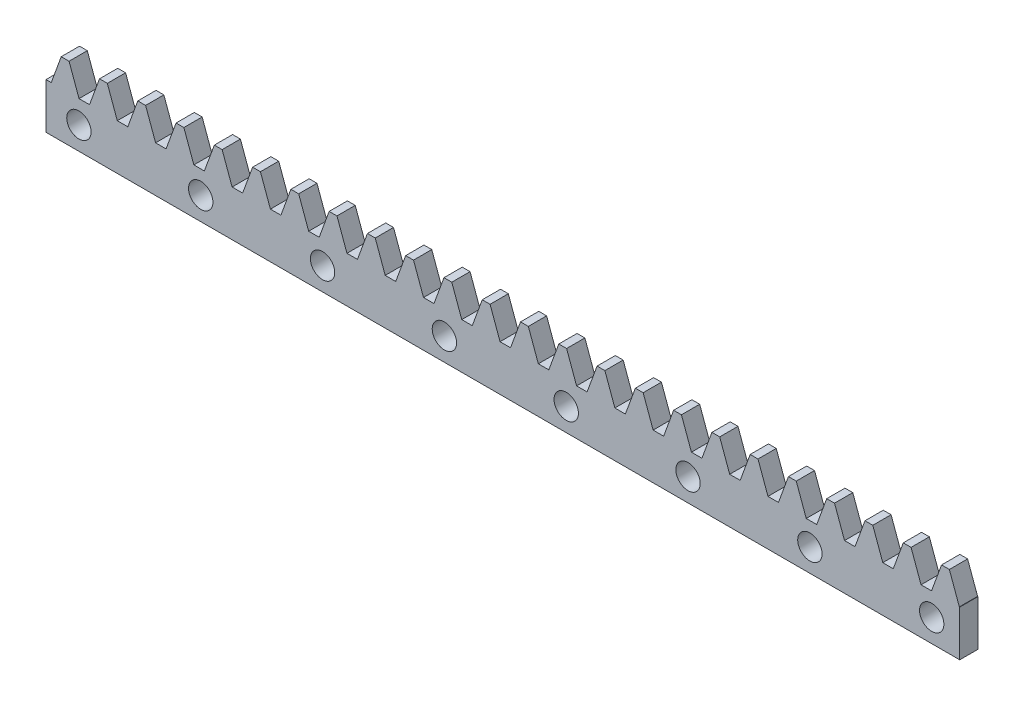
SolidWorks part; units mm, degrees
ref_plane "前视基准面" through (0, 0, 0) normal (0, 0, 1) x (1, 0, 0)
ref_plane "上视基准面" through (0, 0, 0) normal (0, 1, 0) x (1, 0, 0)
ref_plane "右视基准面" through (0, 0, 0) normal (1, 0, 0) x (0, 0, -1)
sketch "草图1" plane through (0, 0, 0) normal (0, 0, 1) x (1, 0, 0)
  line L200 (150, 7.5) -> (149.9346, 7.5)
  line L201 (149.9346, 7.5) -> (148.2967, 12)
  line L202 (148.2967, 12) -> (147.013, 12)
  line L203 (147.013, 12) -> (145.3751, 7.5)
  line L204 (145.3751, 7.5) -> (143.6514, 7.5)
  line L205 (143.6514, 7.5) -> (142.0135, 12)
  line L206 (142.0135, 12) -> (140.7298, 12)
  line L207 (140.7298, 12) -> (139.0919, 7.5)
  line L208 (139.0919, 7.5) -> (137.3682, 7.5)
  line L209 (137.3682, 7.5) -> (135.7303, 12)
  line L210 (135.7303, 12) -> (134.4466, 12)
  line L211 (134.4466, 12) -> (132.8088, 7.5)
  line L212 (132.8088, 7.5) -> (131.085, 7.5)
  line L213 (131.085, 7.5) -> (129.4472, 12)
  line L214 (129.4472, 12) -> (128.1634, 12)
  line L215 (128.1634, 12) -> (126.5256, 7.5)
  line L216 (126.5256, 7.5) -> (124.8018, 7.5)
  line L217 (124.8018, 7.5) -> (123.164, 12)
  line L218 (123.164, 12) -> (121.8803, 12)
  line L219 (121.8803, 12) -> (120.2424, 7.5)
  line L220 (120.2424, 7.5) -> (118.5186, 7.5)
  line L221 (118.5186, 7.5) -> (116.8808, 12)
  line L222 (116.8808, 12) -> (115.5971, 12)
  line L223 (115.5971, 12) -> (113.9592, 7.5)
  line L224 (113.9592, 7.5) -> (112.2355, 7.5)
  line L225 (112.2355, 7.5) -> (110.5976, 12)
  line L226 (110.5976, 12) -> (109.3139, 12)
  line L227 (109.3139, 12) -> (107.676, 7.5)
  line L228 (107.676, 7.5) -> (105.9523, 7.5)
  line L229 (105.9523, 7.5) -> (104.3144, 12)
  line L230 (104.3144, 12) -> (103.0307, 12)
  line L231 (103.0307, 12) -> (101.3928, 7.5)
  line L232 (101.3928, 7.5) -> (99.6691, 7.5)
  line L233 (99.6691, 7.5) -> (98.0312, 12)
  line L234 (98.0312, 12) -> (96.7475, 12)
  line L235 (96.7475, 12) -> (95.1097, 7.5)
  line L236 (95.1097, 7.5) -> (93.3859, 7.5)
  line L237 (93.3859, 7.5) -> (91.748, 12)
  line L238 (91.748, 12) -> (90.4643, 12)
  line L239 (90.4643, 12) -> (88.8265, 7.5)
  line L240 (88.8265, 7.5) -> (87.1027, 7.5)
  line L241 (87.1027, 7.5) -> (85.4649, 12)
  line L242 (85.4649, 12) -> (84.1811, 12)
  line L243 (84.1811, 12) -> (82.5433, 7.5)
  line L244 (82.5433, 7.5) -> (80.8195, 7.5)
  line L245 (80.8195, 7.5) -> (79.1817, 12)
  line L246 (79.1817, 12) -> (77.898, 12)
  line L247 (77.898, 12) -> (76.2601, 7.5)
  line L248 (76.2601, 7.5) -> (74.5364, 7.5)
  line L249 (74.5364, 7.5) -> (72.8985, 12)
  line L250 (72.8985, 12) -> (71.6148, 12)
  line L251 (71.6148, 12) -> (69.9769, 7.5)
  line L252 (69.9769, 7.5) -> (68.2532, 7.5)
  line L253 (68.2532, 7.5) -> (66.6153, 12)
  line L254 (66.6153, 12) -> (65.3316, 12)
  line L255 (65.3316, 12) -> (63.6937, 7.5)
  line L256 (63.6937, 7.5) -> (61.97, 7.5)
  line L257 (61.97, 7.5) -> (60.3321, 12)
  line L258 (60.3321, 12) -> (59.0484, 12)
  line L259 (59.0484, 12) -> (57.4105, 7.5)
  line L260 (57.4105, 7.5) -> (55.6868, 7.5)
  line L261 (55.6868, 7.5) -> (54.0489, 12)
  line L262 (54.0489, 12) -> (52.7652, 12)
  line L263 (52.7652, 12) -> (51.1274, 7.5)
  line L264 (51.1274, 7.5) -> (49.4036, 7.5)
  line L265 (49.4036, 7.5) -> (47.7657, 12)
  line L266 (47.7657, 12) -> (46.482, 12)
  line L267 (46.482, 12) -> (44.8442, 7.5)
  line L268 (44.8442, 7.5) -> (43.1204, 7.5)
  line L269 (43.1204, 7.5) -> (41.4826, 12)
  line L270 (41.4826, 12) -> (40.1988, 12)
  line L271 (40.1988, 12) -> (38.561, 7.5)
  line L272 (38.561, 7.5) -> (36.8372, 7.5)
  line L273 (36.8372, 7.5) -> (35.1994, 12)
  line L274 (35.1994, 12) -> (33.9157, 12)
  line L275 (33.9157, 12) -> (32.2778, 7.5)
  line L276 (32.2778, 7.5) -> (30.5541, 7.5)
  line L277 (30.5541, 7.5) -> (28.9162, 12)
  line L278 (28.9162, 12) -> (27.6325, 12)
  line L279 (27.6325, 12) -> (25.9946, 7.5)
  line L280 (25.9946, 7.5) -> (24.2709, 7.5)
  line L281 (24.2709, 7.5) -> (22.633, 12)
  line L282 (22.633, 12) -> (21.3493, 12)
  line L283 (21.3493, 12) -> (19.7114, 7.5)
  line L284 (19.7114, 7.5) -> (17.9877, 7.5)
  line L285 (17.9877, 7.5) -> (16.3498, 12)
  line L286 (16.3498, 12) -> (15.0661, 12)
  line L287 (15.0661, 12) -> (13.4282, 7.5)
  line L288 (13.4282, 7.5) -> (11.7045, 7.5)
  line L289 (11.7045, 7.5) -> (10.0666, 12)
  line L290 (10.0666, 12) -> (8.7829, 12)
  line L291 (8.7829, 12) -> (7.1451, 7.5)
  line L292 (7.1451, 7.5) -> (5.4213, 7.5)
  line L293 (5.4213, 7.5) -> (3.7834, 12)
  line L294 (3.7834, 12) -> (2.4997, 12)
  line L295 (2.4997, 12) -> (0.8619, 7.5)
  line L296 (0.8619, 7.5) -> (0, 7.5)
  line L297 (0, 7.5) -> (0, 0)
  line L298 (0, 0) -> (150, 0)
  line L299 (150, 0) -> (150, 7.5)
sketch "草图2" plane through (0, 0, 0) normal (0, 0, 1) x (1, 0, 0)
  line L200 (150, 7.5) -> (149.9346, 7.5)
  line L201 (149.9346, 7.5) -> (148.2967, 12)
  line L202 (148.2967, 12) -> (147.013, 12)
  line L203 (147.013, 12) -> (145.3751, 7.5)
  line L204 (145.3751, 7.5) -> (143.6514, 7.5)
  line L205 (143.6514, 7.5) -> (142.0135, 12)
  line L206 (142.0135, 12) -> (140.7298, 12)
  line L207 (140.7298, 12) -> (139.0919, 7.5)
  line L208 (139.0919, 7.5) -> (137.3682, 7.5)
  line L209 (137.3682, 7.5) -> (135.7303, 12)
  line L210 (135.7303, 12) -> (134.4466, 12)
  line L211 (134.4466, 12) -> (132.8088, 7.5)
  line L212 (132.8088, 7.5) -> (131.085, 7.5)
  line L213 (131.085, 7.5) -> (129.4472, 12)
  line L214 (129.4472, 12) -> (128.1634, 12)
  line L215 (128.1634, 12) -> (126.5256, 7.5)
  line L216 (126.5256, 7.5) -> (124.8018, 7.5)
  line L217 (124.8018, 7.5) -> (123.164, 12)
  line L218 (123.164, 12) -> (121.8803, 12)
  line L219 (121.8803, 12) -> (120.2424, 7.5)
  line L220 (120.2424, 7.5) -> (118.5186, 7.5)
  line L221 (118.5186, 7.5) -> (116.8808, 12)
  line L222 (116.8808, 12) -> (115.5971, 12)
  line L223 (115.5971, 12) -> (113.9592, 7.5)
  line L224 (113.9592, 7.5) -> (112.2355, 7.5)
  line L225 (112.2355, 7.5) -> (110.5976, 12)
  line L226 (110.5976, 12) -> (109.3139, 12)
  line L227 (109.3139, 12) -> (107.676, 7.5)
  line L228 (107.676, 7.5) -> (105.9523, 7.5)
  line L229 (105.9523, 7.5) -> (104.3144, 12)
  line L230 (104.3144, 12) -> (103.0307, 12)
  line L231 (103.0307, 12) -> (101.3928, 7.5)
  line L232 (101.3928, 7.5) -> (99.6691, 7.5)
  line L233 (99.6691, 7.5) -> (98.0312, 12)
  line L234 (98.0312, 12) -> (96.7475, 12)
  line L235 (96.7475, 12) -> (95.1097, 7.5)
  line L236 (95.1097, 7.5) -> (93.3859, 7.5)
  line L237 (93.3859, 7.5) -> (91.748, 12)
  line L238 (91.748, 12) -> (90.4643, 12)
  line L239 (90.4643, 12) -> (88.8265, 7.5)
  line L240 (88.8265, 7.5) -> (87.1027, 7.5)
  line L241 (87.1027, 7.5) -> (85.4649, 12)
  line L242 (85.4649, 12) -> (84.1811, 12)
  line L243 (84.1811, 12) -> (82.5433, 7.5)
  line L244 (82.5433, 7.5) -> (80.8195, 7.5)
  line L245 (80.8195, 7.5) -> (79.1817, 12)
  line L246 (79.1817, 12) -> (77.898, 12)
  line L247 (77.898, 12) -> (76.2601, 7.5)
  line L248 (76.2601, 7.5) -> (74.5364, 7.5)
  line L249 (74.5364, 7.5) -> (72.8985, 12)
  line L250 (72.8985, 12) -> (71.6148, 12)
  line L251 (71.6148, 12) -> (69.9769, 7.5)
  line L252 (69.9769, 7.5) -> (68.2532, 7.5)
  line L253 (68.2532, 7.5) -> (66.6153, 12)
  line L254 (66.6153, 12) -> (65.3316, 12)
  line L255 (65.3316, 12) -> (63.6937, 7.5)
  line L256 (63.6937, 7.5) -> (61.97, 7.5)
  line L257 (61.97, 7.5) -> (60.3321, 12)
  line L258 (60.3321, 12) -> (59.0484, 12)
  line L259 (59.0484, 12) -> (57.4105, 7.5)
  line L260 (57.4105, 7.5) -> (55.6868, 7.5)
  line L261 (55.6868, 7.5) -> (54.0489, 12)
  line L262 (54.0489, 12) -> (52.7652, 12)
  line L263 (52.7652, 12) -> (51.1274, 7.5)
  line L264 (51.1274, 7.5) -> (49.4036, 7.5)
  line L265 (49.4036, 7.5) -> (47.7657, 12)
  line L266 (47.7657, 12) -> (46.482, 12)
  line L267 (46.482, 12) -> (44.8442, 7.5)
  line L268 (44.8442, 7.5) -> (43.1204, 7.5)
  line L269 (43.1204, 7.5) -> (41.4826, 12)
  line L270 (41.4826, 12) -> (40.1988, 12)
  line L271 (40.1988, 12) -> (38.561, 7.5)
  line L272 (38.561, 7.5) -> (36.8372, 7.5)
  line L273 (36.8372, 7.5) -> (35.1994, 12)
  line L274 (35.1994, 12) -> (33.9157, 12)
  line L275 (33.9157, 12) -> (32.2778, 7.5)
  line L276 (32.2778, 7.5) -> (30.5541, 7.5)
  line L277 (30.5541, 7.5) -> (28.9162, 12)
  line L278 (28.9162, 12) -> (27.6325, 12)
  line L279 (27.6325, 12) -> (25.9946, 7.5)
  line L280 (25.9946, 7.5) -> (24.2709, 7.5)
  line L281 (24.2709, 7.5) -> (22.633, 12)
  line L282 (22.633, 12) -> (21.3493, 12)
  line L283 (21.3493, 12) -> (19.7114, 7.5)
  line L284 (19.7114, 7.5) -> (17.9877, 7.5)
  line L285 (17.9877, 7.5) -> (16.3498, 12)
  line L286 (16.3498, 12) -> (15.0661, 12)
  line L287 (15.0661, 12) -> (13.4282, 7.5)
  line L288 (13.4282, 7.5) -> (11.7045, 7.5)
  line L289 (11.7045, 7.5) -> (10.0666, 12)
  line L290 (10.0666, 12) -> (8.7829, 12)
  line L291 (8.7829, 12) -> (7.1451, 7.5)
  line L292 (7.1451, 7.5) -> (5.4213, 7.5)
  line L293 (5.4213, 7.5) -> (3.7834, 12)
  line L294 (3.7834, 12) -> (2.4997, 12)
  line L295 (2.4997, 12) -> (0.8619, 7.5)
  line L296 (0.8619, 7.5) -> (0, 7.5)
  line L297 (0, 7.5) -> (0, 0)
  line L298 (0, 0) -> (150, 0)
  line L299 (150, 0) -> (150, 7.5)
extrude "凸台-拉伸1" add sketch "草图1" along normal blind 3 contours L298 L299 L200 L201 L202 L203 L204 L205 L206 L207 L208 L209 L210 L211 L212 L213 L214 L215 L216 L217 L218 L219 L220 L221 L222 L223 L224 L225 L226 L227 L228 L229 L230 L231 L232 L233 L234 L235 L236 L237 L238 L239 L240 L241 L242 L243 L244 L245 L246 L247 L248 L249 L250 L251 L252 L253 L254 L255 L256 L257 L258 L259 L260 L261 L262 L263 L264 L265 L266 L267 L268 L269 L270 L271 L272 L273 L274 L275 L276 L277 L278 L279 L280 L281 L282 L283 L284 L285 L286 L287 L288 L289 L290 L291 L292 L293 L294 L295 L296 L297
sketch "草图3" plane through (0, 0, 3) normal (0, 0, 1) x (1, 0, 0)
  circle A0 centre (5.4011, 3.75) radius 2
  circle A1 centre (25.4011, 3.75) radius 2
  circle A2 centre (45.4011, 3.75) radius 2
  circle A3 centre (65.4011, 3.75) radius 2
  circle A4 centre (85.4011, 3.75) radius 2
  circle A5 centre (105.4011, 3.75) radius 2
  circle A6 centre (125.4011, 3.75) radius 2
  circle A7 centre (145.4011, 3.75) radius 2
extrude "切除-拉伸1" cut sketch "草图3" against normal blind 10 and the other way blind 21
